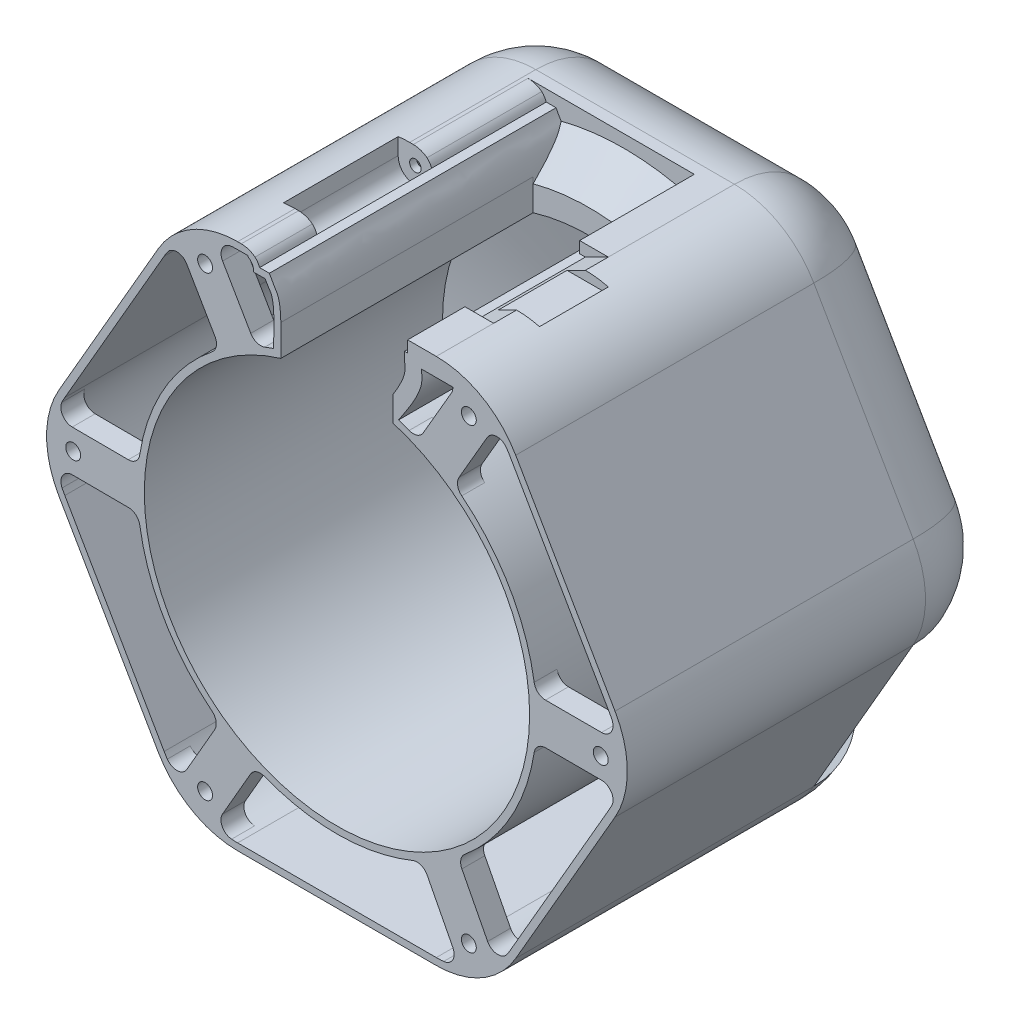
SolidWorks part; units mm, degrees
other "Part 6"
ref_plane "Front Plane" through (0, 0, 0) normal (0, 0, 1) x (1, 0, 0)
ref_plane "Top Plane" through (0, 0, 0) normal (0, 1, 0) x (1, 0, 0)
ref_plane "Right Plane" through (0, 0, 0) normal (1, 0, 0) x (0, 0, -1)
imported_body "Imported3"
sketch "Sketch1" plane through (0, 0, -198) normal (0, 0, -1) x (-1, 0, 0)
  line L0 (51.3142, 111.1219) -> (51.3142, 107.5)
  line L1 (46.5381, 98.6974) -> (35.3808, 79.4808)
  line L2 (50.9868, 70.4936) -> (65.4764, 95.4493)
  arc A0 (73.9409, 95.7416) -> (51.3142, 111.1219) centre (43.3013, 75) ccw
  arc A1 (51.3142, 107.5) -> (46.5381, 98.6974) centre (40.8142, 107.5) cw
  arc A2 (35.3808, 79.4808) -> (50.9868, 70.4936) centre (0, 0) cw
  arc A3 (65.4764, 95.4493) -> (73.9409, 95.7416) centre (69.8004, 92.9387) cw
extrude "Cut-Extrude1" cut sketch "Sketch1" against normal blind 118
ref_plane "Plane1" through (0, 0, -145) normal (0, 0, -1) x (-1, 0, 0)
sketch "Sketch2" plane through (0, 0, -145) normal (0, 0, -1) x (-1, 0, 0)
  line L0 (48.3142, 107.5) -> (48.3142, 115)
  line L1 (48.3142, 115) -> (35.7151, 115)
  line L2 (35.7151, 115) -> (35.7151, 113)
  arc A0 (35.7151, 113) -> (33.7431, 110) centre (40.8142, 107.5) ccw
  arc A1 (33.7431, 110) -> (48.3142, 107.5) centre (40.8142, 107.5) ccw
extrude "Cut-Extrude2" cut sketch "Sketch2" against normal blind 50
sketch "Sketch3" plane through (0, 0, -70) normal (0, 0, 1) x (1, 0, 0)
  line L0 (-49.8558, 104.4116) -> (-46.5381, 98.6974)
  line L1 (-31.2977, 107) -> (-36.342, 107)
  line L2 (-38.7151, 111.4805) -> (-38.7151, 112)
  line L3 (-38.7151, 112) -> (-43.3013, 112)
  arc A0 (-45.8804, 111.91) -> (-49.8558, 104.4116) centre (-45.5318, 106.9222) ccw
  arc A1 (-46.5381, 98.6974) -> (-30.4871, 105.6021) centre (-40.8142, 107.5) ccw
  arc A2 (-30.4871, 105.6021) -> (-31.2977, 107) centre (0.4227, 124.4598) cw
  arc A3 (-36.342, 107) -> (-38.7151, 111.4805) centre (-40.8142, 107.5) ccw
  arc A4 (-43.3013, 112) -> (-45.8804, 111.91) centre (-43.3013, 75) ccw
extrude "Cut-Extrude3" cut sketch "Sketch3" against normal blind 10
sketch "Sketch4" plane through (0, 0, -198) normal (0, 0, -1) x (-1, 0, 0)
  line L0 (43.3013, 112) -> (43.3013, 107)
  line L1 (43.3013, 107) -> (31.2977, 107)
  line L2 (51.3142, 107.5) -> (51.3142, 111.1219)
  arc A0 (31.2977, 107) -> (30.4871, 105.6021) centre (-0.4767, 124.4911) cw
  arc A1 (30.4871, 105.6021) -> (51.3142, 107.5) centre (40.8142, 107.5) ccw
  arc A2 (51.3142, 111.1219) -> (43.3013, 112) centre (43.3013, 75) ccw
extrude "Cut-Extrude4" cut sketch "Sketch4" against normal blind 50
sketch "Sketch5" plane through (0, 0, -80) normal (0, 0, 1) x (1, 0, 0)
  line L0 (-31.2977, 107) -> (-36.342, 107)
  line L1 (-38.7151, 111.4805) -> (-38.7151, 112)
  line L2 (-38.7151, 112) -> (-43.3013, 112)
  line L3 (-51.3142, 111.1219) -> (-51.3142, 107.5)
  arc A0 (-30.4871, 105.6021) -> (-31.2977, 107) centre (0.4227, 124.4598) cw
  arc A1 (-36.342, 107) -> (-38.7151, 111.4805) centre (-40.8142, 107.5) ccw
  arc A2 (-43.3013, 112) -> (-51.3142, 111.1219) centre (-43.3013, 75) ccw
  arc A3 (-51.3142, 107.5) -> (-30.4871, 105.6021) centre (-40.8142, 107.5) ccw
extrude "Cut-Extrude5" cut sketch "Sketch5" against normal blind 12
sketch "Sketch6" plane through (0, 0, -198) normal (0, 0, -1) x (-1, 0, 0)
  line L0 (-44.0088, 111.9932) -> (-43.3013, 111.6395)
  line L1 (-43.3013, 111.6395) -> (-43.3013, 112)
  arc A0 (-43.3013, 112) -> (-44.0088, 111.9932) centre (-43.3013, 75) ccw
extrude "Cut-Extrude6" cut sketch "Sketch6" against normal blind 50
sketch "Sketch7" plane through (0, 0, -70) normal (0, 0, 1) x (1, 0, 0)
  line L0 (43.3013, 112) -> (43.3013, 111.6395)
  line L1 (43.3013, 111.6395) -> (44.0088, 111.9932)
  arc A0 (44.0088, 111.9932) -> (43.3013, 112) centre (43.3013, 75) ccw
extrude "Cut-Extrude7" cut sketch "Sketch7" against normal blind 22
sketch "Sketch8" plane through (0, 0, -145) normal (0, 0, -1) x (-1, 0, 0)
  line L0 (-33.3142, 110) -> (-29.4744, 110)
  line L1 (-29.4744, 110) -> (-29.4744, 115)
  line L2 (-29.4744, 115) -> (-43.3142, 115)
  line L3 (-43.3142, 115) -> (-33.3142, 110)
extrude "Cut-Extrude8" cut sketch "Sketch8" against normal blind 50
sketch "Sketch9" plane through (43.3013, 0, 0) normal (1, 0, 0) x (0, 0, -1)
  line L0 (198, 112) -> (148, 112)
  line L1 (148, 112) -> (148, 107)
  line L2 (148, 107) -> (198, 107)
  line L3 (198, 107) -> (198, 112)
extrude "Cut-Extrude9" cut sketch "Sketch9" against normal blind 9.2789
sketch "Sketch10" plane through (0, 0, -148) normal (0, 0, -1) x (-1, 0, 0)
  line L0 (-43.3013, 107) -> (-34.0224, 107)
  line L1 (-34.0224, 107) -> (-43.3013, 111.6395)
  line L2 (-43.3013, 111.6395) -> (-43.3013, 107)
extrude "Cut-Extrude10" cut sketch "Sketch10" against normal blind 56
sketch "Sketch11" plane through (34.0224, 0, 0) normal (1, 0, 0) x (0, 0, -1)
  line L0 (198, 112) -> (148, 112)
  line L1 (148, 112) -> (148, 107)
  line L2 (148, 107) -> (198, 107)
  line L3 (198, 107) -> (198, 112)
extrude "Cut-Extrude11" cut sketch "Sketch11" against normal blind 0.2082
sketch "Sketch12" plane through (29.4744, 0, 0) normal (-1, 0, 0) x (0, 0, 1)
  line L0 (-145, 110) -> (-145, 115)
  line L1 (-145, 115) -> (-195, 115)
  line L2 (-195, 115) -> (-195, 110)
  line L3 (-195, 110) -> (-145, 110)
extrude "Cut-Extrude12" cut sketch "Sketch12" against normal blind 1.3397
sketch "Sketch13" plane through (43.3013, 0, 0) normal (1, 0, 0) x (0, 0, -1)
  line L0 (92, 112) -> (70, 112)
  line L1 (70, 112) -> (70, 107)
  line L2 (70, 107) -> (92, 107)
  line L3 (92, 107) -> (92, 112)
extrude "Cut-Extrude13" cut sketch "Sketch13" against normal blind 9.2789
sketch "Sketch14" plane through (-43.3013, 0, 0) normal (-1, 0, 0) x (0, 0, 1)
  line L0 (-198, 112) -> (-198, 107)
  line L1 (-198, 107) -> (-148, 107)
  line L2 (-148, 107) -> (-148, 112)
  line L3 (-148, 112) -> (-198, 112)
extrude "Cut-Extrude14" cut sketch "Sketch14" against normal blind 4.5861
sketch "Sketch15" plane through (34.0224, 0, 0) normal (1, 0, 0) x (0, 0, -1)
  line L0 (92, 112) -> (70, 112)
  line L1 (70, 112) -> (70, 107)
  line L2 (70, 107) -> (92, 107)
  line L3 (92, 107) -> (92, 112)
extrude "Cut-Extrude15" cut sketch "Sketch15" against normal blind 0.2082
sketch "Sketch16" plane through (29.4744, 0, 0) normal (-1, 0, 0) x (0, 0, 1)
  line L0 (-70, 115) -> (-95, 115)
  line L1 (-95, 115) -> (-95, 110)
  line L2 (-95, 110) -> (-70, 110)
  line L3 (-70, 110) -> (-70, 115)
extrude "Cut-Extrude16" cut sketch "Sketch16" against normal blind 1.3397
sketch "Sketch17" plane through (0, 0, -198) normal (0, 0, -1) x (-1, 0, 0)
  line L0 (36.342, 107) -> (38.7151, 107)
  line L1 (38.7151, 107) -> (38.7151, 111.4805)
  arc A0 (38.7151, 111.4805) -> (36.342, 107) centre (40.8142, 107.5) ccw
extrude "Cut-Extrude17" cut sketch "Sketch17" against normal blind 50
sketch "Sketch18" plane through (0, 0, 0) normal (0, 1, 0) x (1, 0, 0)
  line L0 (70.743, 240) -> (0, 240)
  line L1 (0, 240) -> (0, 70)
  line L2 (0, 70) -> (84, 70)
  line L3 (84, 70) -> (84, 200.0183)
  line L4 (84, 200.0183) -> (40, 210.6159)
  line L5 (40, 210.6159) -> (40, 213)
  line L6 (45.7177, 223.5) -> (57.243, 223.5)
  line L7 (57.243, 223.5) -> (70.743, 237)
  line L8 (70.743, 237) -> (70.743, 240)
  line L9 (0, 240) -> (0, 70) construction
  arc A0 (40, 213) -> (45.7177, 223.5) centre (52.5, 213) cw
revolve "Cut-Revolve1" cut sketch "Sketch18" angle 360 about L9
hole_wizard "Ø6.5 (6.5) Diameter Hole1" positions "Sketch20" profile "Sketch19" hole size "Ø6.5" standard "ANSI Metric"
sketch "Sketch20" plane through (0, 0, -80) normal (0, 0, -1) x (-1, 0, 0)
  point P0 (-57.5, -99.5929)
  point P1 (-115, 0)
  point P2 (57.5, -99.5929)
  point P3 (-57.5, 99.5929)
  point P4 (115, 0)
  point P5 (57.5, 99.5929)
  dimension "D1" = 115
sketch "Sketch19" plane through (57.5, -99.5929, -80) normal (1, 0, 0) x (0, 1, 0)
  line L0 (0, 0) -> (0, 10.005)
  line L1 (0, 10.005) -> (3.25, 10.005)
  line L2 (3.25, 10.005) -> (3.25, 0)
  line L5 (3.25, 0) -> (0, 0)
  line L11 (0, -6.35) -> (0, 107.95) construction
  dimension "Thru Hole Dia." = 6.5
  dimension "Thru Hole Depth" = 10.005
hole_wizard "Ø5.0 (5) Diameter Hole1" positions "Sketch22" profile "Sketch21" hole size "Ø5.0" standard "ANSI Metric"
sketch "Sketch22" plane through (0, 0, -145) normal (0, 0, 1) x (1, 0, 0)
  point P0 (-40.8142, 107.5)
sketch "Sketch21" plane through (-40.8142, 107.5, -145) normal (1, 0, 0) x (0, -1, 0)
  line L0 (0, 0) -> (0, 3)
  line L1 (0, 3) -> (2.5, 3)
  line L2 (2.5, 3) -> (2.5, 0)
  line L5 (2.5, 0) -> (0, 0)
  line L11 (0, -6.35) -> (0, 107.95) construction
  dimension "Thru Hole Dia." = 5
  dimension "Thru Hole Depth" = 3
hole_wizard "Ø5.0 (5) Diameter Hole2" positions "Sketch24" profile "Sketch23" hole size "Ø5.0" standard "ANSI Metric"
sketch "Sketch24" plane through (0, 0, -92) normal (0, 0, 1) x (1, 0, 0)
  point P0 (-40.8142, 107.5)
sketch "Sketch23" plane through (-40.8142, 107.5, -92) normal (1, 0, 0) x (0, -1, 0)
  line L0 (0, 0) -> (0, 3)
  line L1 (0, 3) -> (2.5, 3)
  line L2 (2.5, 3) -> (2.5, 0)
  line L5 (2.5, 0) -> (0, 0)
  line L11 (0, -6.35) -> (0, 107.95) construction
  dimension "Thru Hole Dia." = 5
  dimension "Thru Hole Depth" = 3
fillet "Fillet1" radius 5 12 edges at (35.4019, 79.4714, -75) (86.5359, -8.9742, -75) (86.5296, 9.0346, -75) (51.0056, 70.48, -75) (-86.5129, -9.1935, -75) (-35.3808, 79.4808, -75) (-35.5116, -79.4225, -75) (-86.5522, 8.8155, -75) (37.1789, -78.6558, -75) (52.5951, -69.3019, -75) (-51.1028, -70.4095, -75) (-50.9868, 70.4936, -75)
fillet "Fillet2" radius 11.1378 1 edges at (45.7177, 0, -223.5)
fillet "Fillet3" radius 37 12 edges at (0, 112, -237) (-61.8013, 107.0429, -237) (-96.9948, 56, -237) (61.8013, 107.0429, -237) (96.9948, 56, -237) (-123.6025, 0, -237) (-96.9948, -56, -237) (123.6025, 0, -237) (96.9948, -56, -237) (-61.8013, -107.0429, -237) (0, -112, -237) (61.8013, -107.0429, -237)
fillet "Fillet4" radius 40 12 edges at (66.3953, -115, -155) (-66.3953, -115, -155) (0, -115, -240) (99.5929, -57.5, -240) (132.7906, 0, -155) (-132.7906, 0, -155) (-99.5929, -57.5, -240) (66.3953, 115, -155) (99.5929, 57.5, -240) (-99.5929, 57.5, -240) (0, 115, -240) (-66.3953, 115, -155)
ref_plane "Plane2" through (0, 125, 0) normal (0, 1, 0) x (1, 0, 0)
other "Move Face4" parameters "D1"=11.928
other "Move Face5" parameters "D1"=79.3715
other "Move Face6" parameters "D1"=6.297
other "Move Face7" parameters "D1"=4.366
sketch "Sketch25" plane through (0, 125, 0) normal (0, 1, 0) x (1, 0, 0)
  line L1 (-24.4584, 180) -> (24.4584, 180)
  line L2 (-24.4584, 180) -> (-24.4584, 70)
  line L3 (-24.4584, 70) -> (24.4584, 70)
  line L4 (24.4584, 180) -> (24.4584, 70)
extrude "Cut-Extrude18" cut sketch "Sketch25" against normal blind 50
other "Move Face8"
other "Move Face9" parameters "D1"=5.3035
ref_plane "Plane3" through (0, 115, 0) normal (0, 1, 0) x (1, 0, 0)
ref_plane "Plane4" through (99.5929, -57.5, 0) normal (0.866, -0.5, 0) x (0, 0, -1)
ref_plane "Plane5" through (79.6743, -46, 0) normal (0.866, -0.5, 0) x (0, 0, -1)
sketch "Sketch30" plane through (0, 115, 0) normal (0, 1, 0) x (1, 0, 0)
  line L0 (33.3142, 95) -> (33.3142, 145) construction
  line L1 (33.3142, 135) -> (53.3142, 135)
  line L2 (33.3142, 135) -> (33.3142, 105)
  line L3 (33.3142, 105) -> (53.3142, 105)
  line L4 (53.3142, 135) -> (53.3142, 105)
  line L5 (30.8142, 145) -> (43.3013, 145) construction
  point P8 (37.0577, 145)
  dimension "D1" = 20
  dimension "D2" = 30
  dimension "D3" = 10
extrude "Cut-Extrude19" cut sketch "Sketch30" against normal blind 4
sketch "Sketch35" plane through (79.6743, -46, 0) normal (0.866, -0.5, 0) x (0, 0, -1)
  line L0 (200, -43.3013) -> (200, 43.3013) construction
  line L1 (197, 46.3013) -> (233, 46.3013)
  line L2 (197, 46.3013) -> (197, -46.3013)
  line L3 (197, -46.3013) -> (233, -46.3013)
  line L4 (233, 46.3013) -> (233, -46.3013)
  line L5 (240, 43.3013) -> (200, 43.3013) construction
  line L6 (240, -43.3013) -> (200, -43.3013) construction
  dimension "D1" = 3
  dimension "D2" = 36
  dimension "D3" = 3
  dimension "D4" = 3
extrude "Boss-Extrude6" add sketch "Sketch35" along normal up to body
sketch "Sketch32" plane through (99.5929, -57.5, 0) normal (0.866, -0.5, 0) x (0, 0, -1)
  line L6 (240, -43.3013) -> (200, -43.3013) construction
  line L7 (200, 43.3013) -> (232, 43.3013)
  line L8 (200, 43.3013) -> (200, -43.3013)
  line L9 (200, -43.3013) -> (232, -43.3013)
  line L10 (232, 43.3013) -> (232, -43.3013)
  dimension "D1" = 32
extrude "Cut-Extrude21" cut sketch "Sketch32" against normal blind 16
ref_plane "Plane7" through (0, 0, 0) normal (-0.5, -0.866, 0) x (-0.866, 0.5, 0)
sketch "Sketch36" plane through (0, 0, 0) normal (-0.5, -0.866, 0) x (-0.866, 0.5, 0)
  line L0 (-95, 200) -> (-115, 200) construction
  line L2 (-95, 200) -> (-95, 70) construction
  circle A0 centre (-105, 210) radius 3
  dimension "D1" = 10
  dimension "D2" = 10
extrude "Cut-Extrude22" cut sketch "Sketch36" against normal up to next and the other way up to next
fillet "Fillet5" radius 10 2 edges at (-35.7151, 115, -82.5) (-35.7151, 115, -170)
